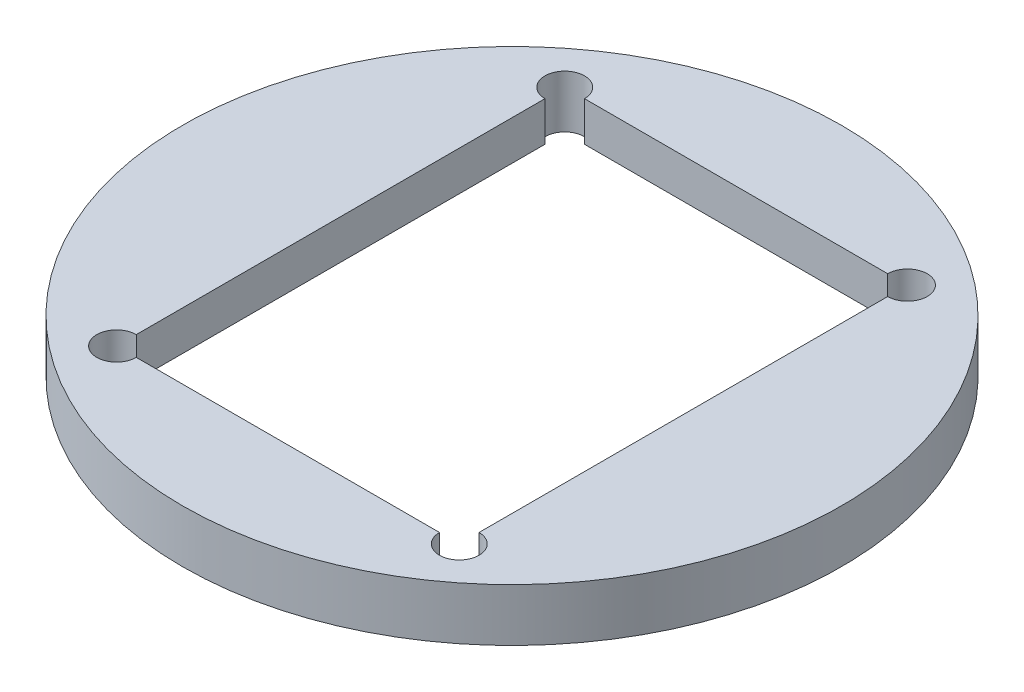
SolidWorks part; units mm, degrees
ref_plane "Front Plane" through (0, 0, 0) normal (0, 0, 1) x (1, 0, 0)
ref_plane "Top Plane" through (0, 0, 0) normal (0, 1, 0) x (1, 0, 0)
ref_plane "Right Plane" through (0, 0, 0) normal (1, 0, 0) x (0, 0, -1)
sketch "Sketch1" plane through (0, 0, 0) normal (0, 1, 0) x (1, 0, 0)
  line L1 (1.651, -2.159) -> (-1.651, -2.159)
  line L2 (1.651, -2.159) -> (1.651, 2.159)
  line L3 (1.651, 2.159) -> (-1.651, 2.159)
  line L4 (-1.651, -2.159) -> (-1.651, 2.159)
  line L5 (1.651, -2.159) -> (-1.651, 2.159) construction
  line L6 (1.651, 2.159) -> (-1.651, -2.159) construction
  circle A0 centre (0, 0) radius 3.175
  dimension "D3" = 6.35
  dimension "D1" = 3.302
  dimension "D2" = 4.318
extrude "Boss-Extrude1" add sketch "Sketch1" along normal blind 0.508
chamfer "Chamfer1" distance 0.127 angle 45 4 edges at (0, 0, 2.159) (1.651, 0, 0) (0, 0, -2.159) (-1.651, 0, 0)
sketch "Sketch2" plane through (0, 0.508, 0) normal (0, 1, 0) x (1, 0, 0)
  circle A0 centre (1.651, -2.159) radius 0.1905
  circle A1 centre (-1.651, -2.159) radius 0.1905
  circle A2 centre (-1.651, 2.159) radius 0.1905
  circle A3 centre (1.651, 2.159) radius 0.1905
  dimension "D1" = 0.381
extrude "Cut-Extrude1" cut sketch "Sketch2" against normal through all
